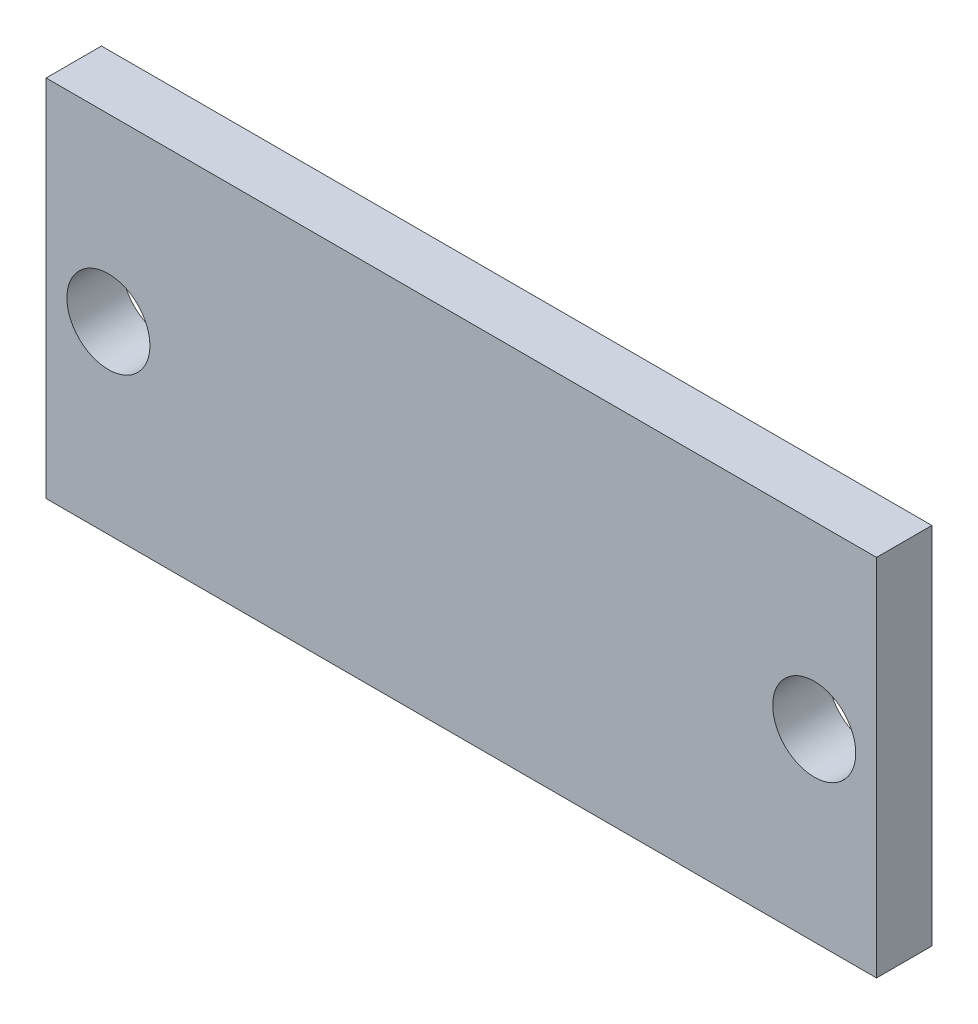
SolidWorks part; units mm, degrees
ref_plane "Planta" through (0, 0, 0) normal (0, 0, 1) x (1, 0, 0)
ref_plane "Perfil" through (0, 0, 0) normal (0, 1, 0) x (1, 0, 0)
ref_plane "Alzado" through (0, 0, 0) normal (1, 0, 0) x (0, 0, -1)
sketch "Croquis1" plane through (0, 0, 0) normal (0, 0, 1) x (1, 0, 0)
  line L1 (15, -6.58) -> (-15, -6.58)
  line L2 (15, -6.58) -> (15, 6.58)
  line L3 (15, 6.58) -> (-15, 6.58)
  line L4 (-15, -6.58) -> (-15, 6.58)
  line L5 (15, -6.58) -> (-15, 6.58) construction
  line L6 (15, 6.58) -> (-15, -6.58) construction
  circle A0 centre (-12.75, 0.08) radius 1.5
  circle A1 centre (12.75, 0.08) radius 1.5
  point P0 (0, 0)
  dimension "D3" = 3
  dimension "D4" = 3
  dimension "D5" = 6.5
  dimension "D6" = 6.5
  dimension "D8" = 2.25
  dimension "D1" = 30
  dimension "D2" = 13.16
  dimension "D7" = 2.25
extrude "Saliente-Extruir1" add sketch "Croquis1" along normal blind 2
